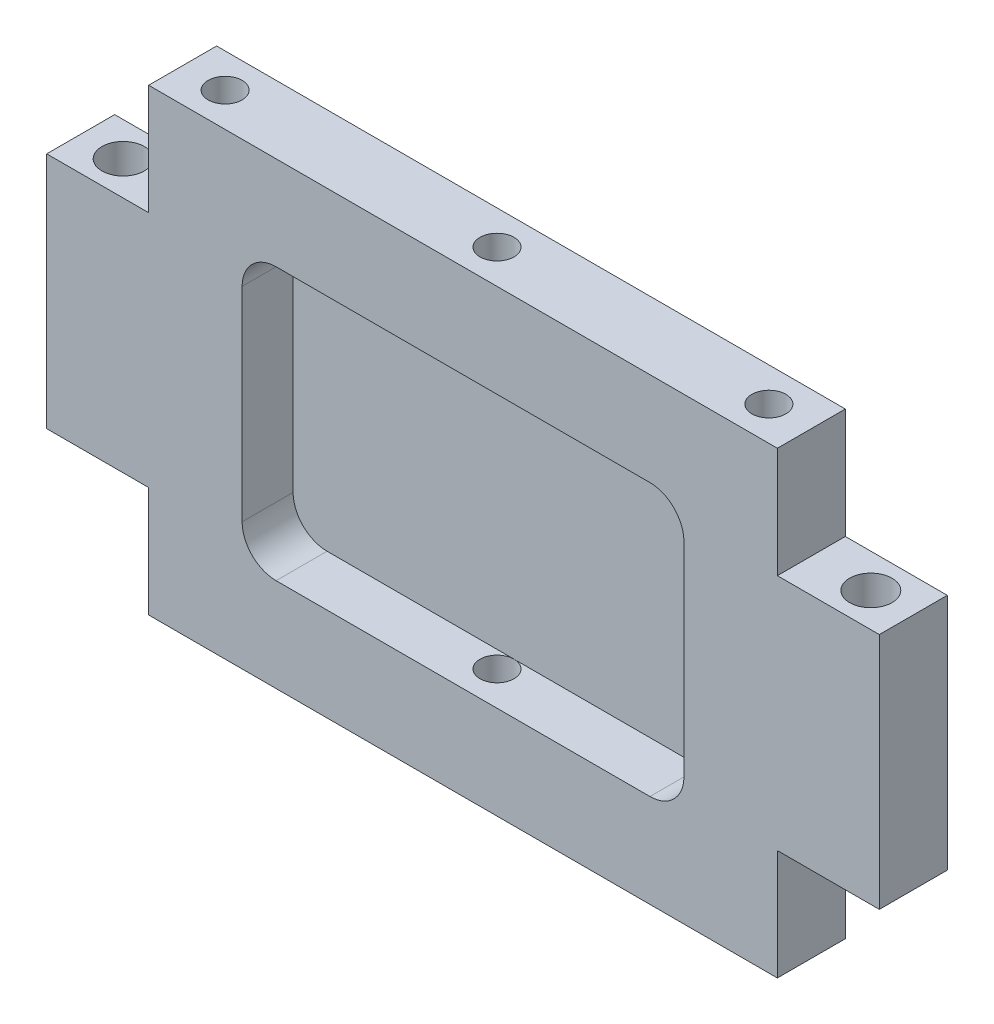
SolidWorks part; units mm, degrees
ref_plane "Front Plane" through (0, 0, 0) normal (0, 0, 1) x (1, 0, 0)
ref_plane "Top Plane" through (0, 0, 0) normal (0, 1, 0) x (1, 0, 0)
ref_plane "Right Plane" through (0, 0, 0) normal (1, 0, 0) x (0, 0, -1)
sketch "Sketch1" plane through (0, 0, 0) normal (0, 0, 1) x (1, 0, 0)
  line L0 (0, 0) -> (69.85, 0) construction
  line L1 (0, 0) -> (0, 42.8625) construction
  line L2 (-58.7375, -42.8625) -> (58.7375, -42.8625)
  line L3 (58.7375, -42.8625) -> (58.7375, -22.2377)
  line L4 (58.7375, -22.2377) -> (77.7875, -22.2377)
  line L5 (77.7875, -22.2377) -> (77.7875, 22.2377)
  line L6 (77.7875, 22.2377) -> (58.7375, 22.2377)
  line L7 (58.7375, 22.2377) -> (58.7375, 42.8625)
  line L8 (58.7375, 42.8625) -> (-58.7375, 42.8625)
  line L9 (-58.7375, 42.8625) -> (-58.7375, 22.2377)
  line L10 (-58.7375, 22.2377) -> (-77.7875, 22.2377)
  line L11 (-77.7875, 22.2377) -> (-77.7875, -22.2377)
  line L12 (-77.7875, -22.2377) -> (-58.7375, -22.2377)
  line L13 (-58.7375, -22.2377) -> (-58.7375, -42.8625)
  line L14 (-50.8, 0) -> (-50.8, 42.8625) construction
  line L15 (50.8, 0) -> (50.8, 42.8625) construction
  line L16 (-69.85, 22.2377) -> (-69.85, -22.2377) construction
  line L17 (69.85, 22.2377) -> (69.85, -22.2377) construction
  line L18 (-50.8, -42.8625) -> (-50.8, 0) construction
  line L19 (0, -42.8625) -> (0, 0) construction
  line L20 (50.8, -42.8625) -> (50.8, 0) construction
  line L21 (0, 0) -> (-69.85, 0) construction
  circle A0 centre (-42.8625, -22.225) radius 3.9624
  circle A1 centre (-42.8625, 22.225) radius 3.9624
  circle A2 centre (-17.4625, 28.575) radius 3.9624
  circle A3 centre (-17.4625, -28.575) radius 3.9624
  circle A4 centre (-80.9625, 0) radius 4.7625
  circle A5 centre (11.1125, -28.575) radius 3.9624
  circle A6 centre (11.1125, 28.575) radius 3.9624
  circle A7 centre (-61.9252, 7.9375) radius 3.175
  circle A8 centre (-61.9252, -7.9375) radius 3.175
  dimension "D5" = 7.9248
  dimension "D14" = 9.525
  dimension "D17" = 6.35
  dimension "D1" = 85.725
  dimension "D2" = 19.05
  dimension "D3" = 19.05
  dimension "D4" = 20.6248
  dimension "D6" = 139.7
  dimension "D7" = 101.6
  dimension "D8" = 57.15
  dimension "D9" = 15.875
  dimension "D10" = 25.4
  dimension "D11" = 22.225
  dimension "D12" = 44.45
  dimension "D13" = 28.575
  dimension "D15" = 77.7875
  dimension "D16" = 44.4754
  dimension "D18" = 7.9248
  dimension "D19" = 15.875
sketch "Sketch2" plane through (0, 0, 0) normal (0, 0, 1) x (1, 0, 0)
  line L0 (-58.7375, -42.8625) -> (58.7375, -42.8625) construction
  line L1 (58.7375, -42.8625) -> (58.7375, -22.2377) construction
  line L2 (58.7375, -22.2377) -> (77.7875, -22.2377) construction
  line L3 (77.7875, -22.2377) -> (77.7875, 22.2377) construction
  line L4 (77.7875, 22.2377) -> (58.7375, 22.2377) construction
  line L5 (58.7375, 22.2377) -> (58.7375, 42.8625) construction
  line L6 (58.7375, 42.8625) -> (-58.7375, 42.8625) construction
  line L7 (-58.7375, 42.8625) -> (-58.7375, 22.2377) construction
  line L8 (-58.7375, 22.2377) -> (-77.7875, 22.2377) construction
  line L9 (-77.7875, 22.2377) -> (-77.7875, -22.2377) construction
  line L10 (-77.7875, -22.2377) -> (-58.7375, -22.2377) construction
  line L11 (-58.7375, -22.2377) -> (-58.7375, -42.8625) construction
  line L12 (-58.7375, -42.8625) -> (58.7375, -42.8625)
  line L13 (58.7375, -42.8625) -> (58.7375, -22.2377)
  line L14 (58.7375, -22.2377) -> (77.7875, -22.2377)
  line L15 (77.7875, -22.2377) -> (77.7875, 22.2377)
  line L16 (77.7875, 22.2377) -> (58.7375, 22.2377)
  line L17 (58.7375, 22.2377) -> (58.7375, 42.8625)
  line L18 (58.7375, 42.8625) -> (-58.7375, 42.8625)
  line L19 (-58.7375, 42.8625) -> (-58.7375, 22.2377)
  line L20 (-58.7375, 22.2377) -> (-77.7875, 22.2377)
  line L21 (-77.7875, 22.2377) -> (-77.7875, -22.2377)
  line L22 (-77.7875, -22.2377) -> (-58.7375, -22.2377)
  line L23 (-58.7375, -22.2377) -> (-58.7375, -42.8625)
extrude "Boss-Extrude1" add sketch "Sketch2" along normal mid plane 12.7
sketch "Sk-side" plane through (0, 0, 0) normal (0, 1, 0) x (1, 0, 0)
  line L0 (-85.725, 0) -> (-76.2, 0) construction
  line L1 (-85.725, 0) -> (-76.2, 0)
  circle A0 centre (-69.85, 0) radius 3.9624
  circle A1 centre (69.85, 0) radius 3.9624
  circle A2 centre (-50.8, 0) radius 3.175
  circle A3 centre (0, 0) radius 3.175
  circle A4 centre (50.8, 0) radius 3.175
  dimension "D1" = 7.9248
  dimension "D2" = 6.35
sketch "Sketch4" plane through (0, 0, 0) normal (0, 1, 0) x (1, 0, 0)
  circle A0 centre (-69.85, 0) radius 3.9624 construction
  circle A1 centre (69.85, 0) radius 3.9624 construction
  circle A2 centre (-69.85, 0) radius 3.9624
  circle A3 centre (69.85, 0) radius 3.9624
extrude "Cut-Extrude1" cut sketch "Sketch4" against normal mid plane 76.2
hole_wizard "1/4 (0.25) Diameter Hole1" positions "Sketch6" profile "Sketch5" hole size "1/4" standard "ANSI Inch"
sketch "Sketch6" plane through (0, -42.8625, 0) normal (0, -1, 0) x (-1, 0, 0)
  point P0 (50.8, 0)
  point P3 (0, 0)
  point P6 (-50.8, 0)
sketch "Sketch5" plane through (-50.8, -42.8625, 0) normal (1, 0, 0) x (0, 0, -1)
  line L0 (0, 0) -> (0, 20.9577)
  line L1 (0, 20.9577) -> (3.175, 19.05)
  line L2 (3.175, 19.05) -> (3.175, 0)
  line L5 (3.175, 0) -> (0, 0)
  line L10 (0, 20.9577) -> (-3.175, 19.05) construction
  line L11 (0, -6.35) -> (0, 107.95) construction
  dimension "Hole Dia." = 6.35
  dimension "Hole Depth" = 19.05
  dimension "Drill Angle" = 118
hole_wizard "1/4 (0.25) Diameter Hole2" positions "Sketch8" profile "Sketch7" hole size "1/4" standard "ANSI Inch"
sketch "Sketch8" plane through (0, 42.8625, 0) normal (0, 1, 0) x (1, 0, 0)
  point P0 (-50.8, 0)
  point P3 (0, 0)
  point P6 (50.8, 0)
sketch "Sketch7" plane through (-50.8, 42.8625, 0) normal (1, 0, 0) x (0, 0, 1)
  line L0 (0, 0) -> (0, 20.9577)
  line L1 (0, 20.9577) -> (3.175, 19.05)
  line L2 (3.175, 19.05) -> (3.175, 0)
  line L5 (3.175, 0) -> (0, 0)
  line L10 (0, 20.9577) -> (-3.175, 19.05) construction
  line L11 (0, -6.35) -> (0, 107.95) construction
  dimension "Hole Dia." = 6.35
  dimension "Hole Depth" = 19.05
  dimension "Drill Angle" = 118
sketch "Sketch9" [suppressed] plane through (0, 0, 0) normal (0, 0, 1) x (1, 0, 0)
  circle A0 centre (-42.8625, -22.225) radius 3.9624 construction
  circle A1 centre (-42.8625, 22.225) radius 3.9624 construction
  circle A2 centre (-17.4625, 28.575) radius 3.9624 construction
  circle A3 centre (-17.4625, -28.575) radius 3.9624 construction
  circle A4 centre (-42.8625, -22.225) radius 3.9624
  circle A5 centre (-42.8625, 22.225) radius 3.9624
  circle A6 centre (-17.4625, 28.575) radius 3.9624
  circle A7 centre (-17.4625, -28.575) radius 3.9624
  circle A8 centre (11.1125, -28.575) radius 3.9624 construction
  circle A9 centre (11.1125, 28.575) radius 3.9624 construction
  circle A10 centre (11.1125, -28.575) radius 3.9624
  circle A11 centre (11.1125, 28.575) radius 3.9624
  circle A12 centre (-80.9625, 0) radius 4.7625 construction
  circle A13 centre (-80.9625, 0) radius 4.7625
extrude "Cut-Extrude2" [suppressed] cut sketch "Sketch9" against normal mid plane 25.4
sketch "Sketch10" plane through (0, 0, 0) normal (0, 0, 1) x (1, 0, 0)
  line L0 (-41.275, 25.4) -> (-41.275, -25.4)
  line L1 (-41.275, -25.4) -> (41.275, -25.4)
  line L2 (41.275, -25.4) -> (41.275, 25.4)
  line L3 (41.275, 25.4) -> (-41.275, 25.4)
  line L4 (0, 0) -> (24.8603, 0) construction
  line L5 (0, 0) -> (0, 13.8498) construction
  dimension "D1" = 50.8
  dimension "D2" = 82.55
extrude "Cut-Extrude3" cut sketch "Sketch10" against normal blind 3.175 and the other way blind 25.4
fillet "Fillet1" radius 6.35 4 edges at (41.275, 25.4, 1.5875) (41.275, -25.4, 1.5875) (-41.275, -25.4, 1.5875) (-41.275, 25.4, 1.5875)
